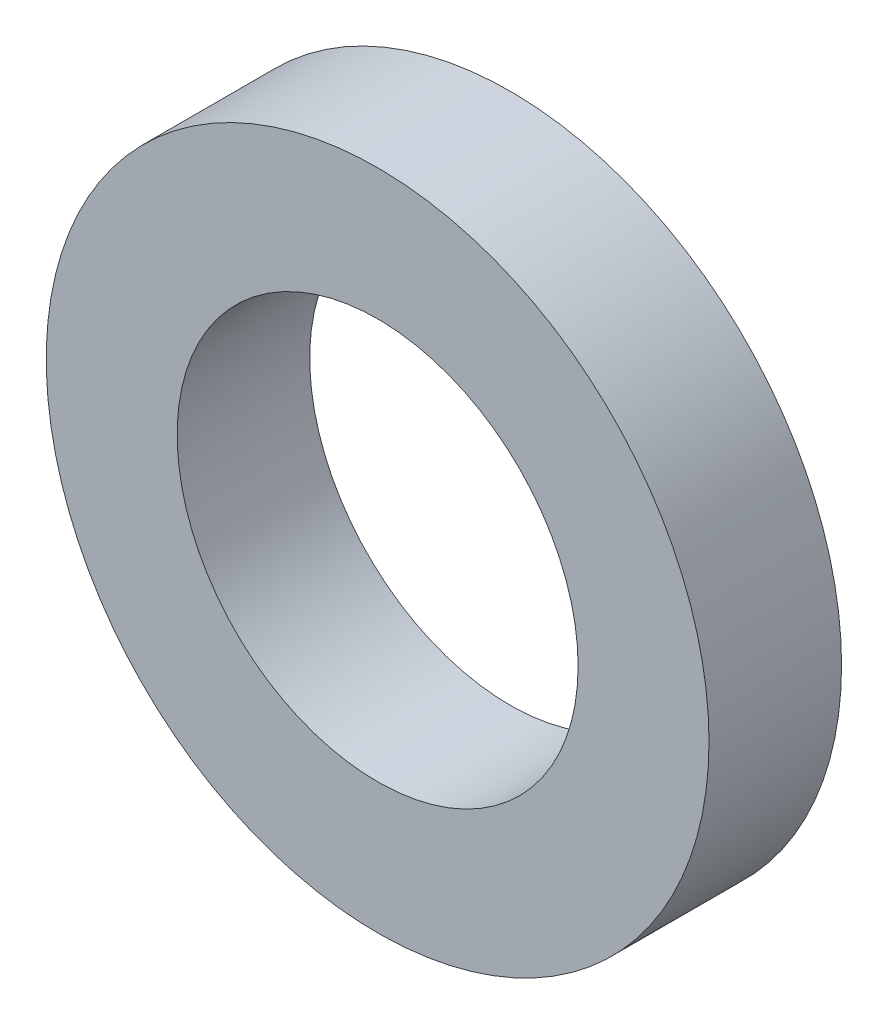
SolidWorks part; units mm, degrees
ref_plane "Plan de face" through (0, 0, 0) normal (0, 0, 1) x (1, 0, 0)
ref_plane "Plan de dessus" through (0, 0, 0) normal (0, 1, 0) x (1, 0, 0)
ref_plane "Plan de droite" through (0, 0, 0) normal (1, 0, 0) x (0, 0, -1)
sketch "Esquisse1" plane through (0, 0, 0) normal (0, 0, 1) x (1, 0, 0)
  circle A0 centre (0, 0) radius 10
  circle A1 centre (0, 0) radius 6.05
  dimension "D1" = 20
  dimension "D2" = 12.1
extrude "Extrusion1" add sketch "Esquisse1" along normal blind 4
